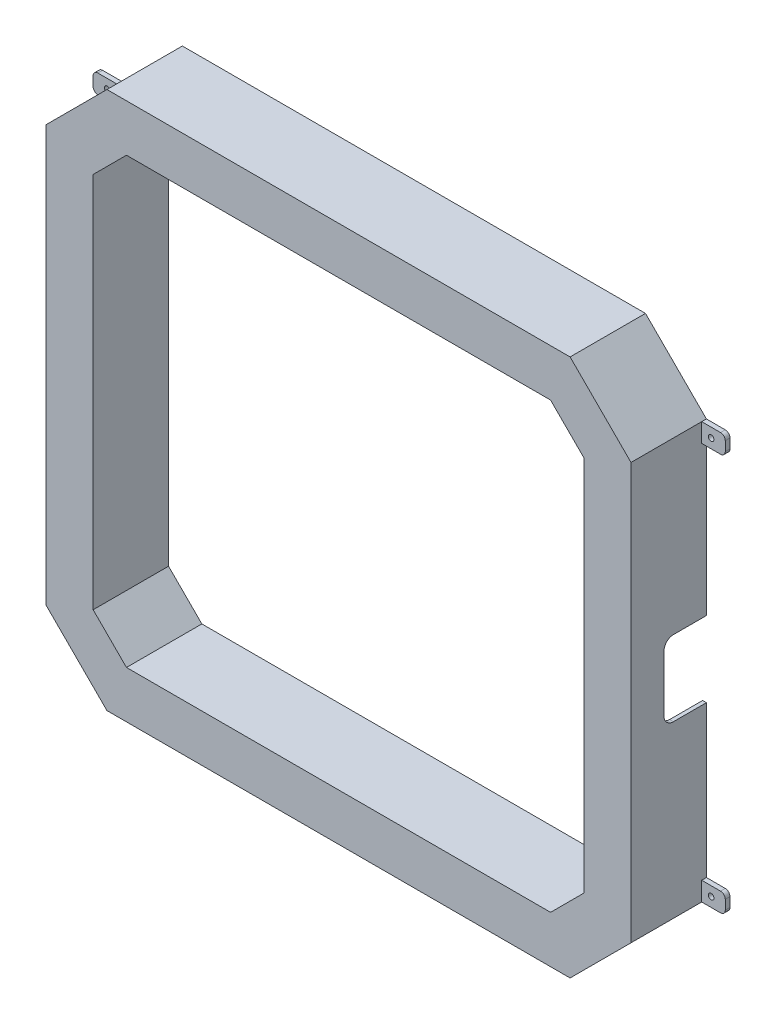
SolidWorks part; units mm, degrees
ref_plane "Plan de face" through (0, 0, 0) normal (0, 0, 1) x (1, 0, 0)
ref_plane "Plan de dessus" through (0, 0, 0) normal (0, 1, 0) x (1, 0, 0)
ref_plane "Plan de droite" through (0, 0, 0) normal (1, 0, 0) x (0, 0, -1)
sketch "Esquisse1" plane through (0, 0, 0) normal (0, 0, 1) x (1, 0, 0)
  line L0 (0, 0) -> (-450, 0)
  line L1 (-450, 0) -> (-485.3553, -35.3553)
  line L2 (-485.3553, -35.3553) -> (-485.3553, -435.3553)
  line L3 (-485.3553, -435.3553) -> (-450, -470.7107)
  line L4 (-450, -470.7107) -> (0, -470.7107)
  line L5 (0, -470.7107) -> (35.3553, -435.3553)
  line L6 (35.3553, -435.3553) -> (35.3553, -35.3553)
  line L7 (35.3553, -35.3553) -> (0, 0)
  line L8 (-535.3553, -14.6447) -> (-535.3553, -456.066)
  line L9 (-535.3553, -456.066) -> (-470.7107, -520.7107)
  line L10 (-470.7107, -520.7107) -> (20.7107, -520.7107)
  line L11 (20.7107, -520.7107) -> (85.3553, -456.066)
  line L12 (85.3553, -456.066) -> (85.3553, -14.6447)
  line L13 (85.3553, -14.6447) -> (20.7107, 50)
  line L14 (20.7107, 50) -> (-470.7107, 50)
  line L15 (-470.7107, 50) -> (-535.3553, -14.6447)
  point P6 (0, -539.506)
  point P10 (65.1411, -65.1411)
  point P11 (-409.4708, -587.2776)
  point P12 (0, 0)
  point P13 (0, 0)
  point P14 (67.5804, -517.5804)
  point P15 (0, -563.577)
  point P24 (-50, -483.1763)
  point P25 (-450, 0)
  point P26 (85.2384, -422.2618)
  point P27 (-450, -603.2595)
  point P28 (-450, -507.252)
  dimension "D1" = 450
  dimension "D2" = 400
  dimension "D3" = 135
  dimension "D4" = 50
  dimension "D5" = 135
  dimension "D6" = 50
extrude "Boss.-Extru.1" add sketch "Esquisse1" along normal blind 80
shell "Coque1" thickness 4
sketch "Esquisse2" plane through (85.3553, 0, 0) normal (1, 0, 0) x (0, 0, -1)
  line L0 (0, -195.3553) -> (-35, -195.3553)
  line L1 (0, -456.066) -> (0, -14.6447) construction
  line L3 (-45, -205.3553) -> (-45, -265.3553)
  line L4 (-35, -275.3553) -> (0, -275.3553)
  line L5 (0, -275.3553) -> (0, -195.3553)
  arc A0 (-35, -195.3553) -> (-45, -205.3553) centre (-35, -205.3553) ccw
  arc A1 (-45, -265.3553) -> (-35, -275.3553) centre (-35, -265.3553) ccw
  point P4 (0, -90.7541)
  point P5 (0, -235.3553)
  point P11 (0, -193.1025)
  point P13 (0, -273.1025)
  point P14 (0, 0)
  point P15 (0, -235.3553)
  dimension "D1" = 10
  dimension "D2" = 80
  dimension "D3" = 35
extrude "Enlèv. mat.-Extru.1" cut sketch "Esquisse2" against normal up to next
sketch "Esquisse3" plane through (-535.3553, 0, 0) normal (-1, 0, 0) x (0, 0, 1)
  line L4 (35, -195.3553) -> (0, -195.3553)
  line L5 (45, -265.3553) -> (45, -205.3553)
  line L6 (0, -275.3553) -> (35, -275.3553)
  line L7 (0, -195.3553) -> (0, -275.3553)
  line L8 (35, -195.3553) -> (0, -195.3553)
  line L9 (45, -265.3553) -> (45, -205.3553)
  line L10 (0, -275.3553) -> (35, -275.3553)
  line L11 (0, -195.3553) -> (0, -275.3553)
  arc A2 (45, -205.3553) -> (35, -195.3553) centre (35, -205.3553) ccw
  arc A3 (35, -275.3553) -> (45, -265.3553) centre (35, -265.3553) ccw
  arc A4 (45, -205.3553) -> (35, -195.3553) centre (35, -205.3553) ccw
  arc A5 (35, -275.3553) -> (45, -265.3553) centre (35, -265.3553) ccw
  dimension "D1" = 0
extrude "Enlèv. mat.-Extru.2" cut sketch "Esquisse3" against normal up to next
sketch "Esquisse5" plane through (0, 0, 0) normal (0, 0, -1) x (-1, 0, 0)
  line L0 (0, 0) -> (450, 0) construction
  line L1 (535.3553, -14.6447) -> (555.3553, -14.6447)
  line L2 (535.3553, -14.6447) -> (535.3553, -34.6447)
  line L3 (535.3553, -34.6447) -> (555.3553, -34.6447)
  line L4 (560.3553, -19.6447) -> (560.3553, -29.6447)
  line L5 (225, 0) -> (225, -470.7107) construction
  line L6 (450, -470.7107) -> (0, -470.7107) construction
  line L11 (225, -235.3553) -> (485.3553, -235.3553) construction
  line L12 (485.3553, -35.3553) -> (485.3553, -435.3553) construction
  line L22 (-110.3553, -19.6447) -> (-110.3553, -29.6447)
  line L23 (-85.3553, -34.6447) -> (-105.3553, -34.6447)
  line L24 (-85.3553, -14.6447) -> (-85.3553, -34.6447)
  line L25 (-85.3553, -14.6447) -> (-105.3553, -14.6447)
  line L26 (-85.3553, -456.066) -> (-105.3553, -456.066)
  line L27 (-85.3553, -456.066) -> (-85.3553, -436.066)
  line L28 (-85.3553, -436.066) -> (-105.3553, -436.066)
  line L29 (-110.3553, -451.066) -> (-110.3553, -441.066)
  line L30 (560.3553, -451.066) -> (560.3553, -441.066)
  line L31 (535.3553, -436.066) -> (555.3553, -436.066)
  line L32 (535.3553, -456.066) -> (535.3553, -436.066)
  line L33 (535.3553, -456.066) -> (555.3553, -456.066)
  circle A3 centre (545.3553, -24.6447) radius 3
  arc A4 (555.3553, -34.6447) -> (560.3553, -29.6447) centre (555.3553, -29.6447) ccw
  arc A5 (555.3553, -14.6447) -> (560.3553, -19.6447) centre (555.3553, -19.6447) cw
  arc A6 (-105.3553, -14.6447) -> (-110.3553, -19.6447) centre (-105.3553, -19.6447) ccw
  arc A7 (-105.3553, -34.6447) -> (-110.3553, -29.6447) centre (-105.3553, -29.6447) cw
  circle A8 centre (-95.3553, -24.6447) radius 3
  circle A9 centre (-95.3553, -446.066) radius 3
  arc A10 (-105.3553, -436.066) -> (-110.3553, -441.066) centre (-105.3553, -441.066) ccw
  arc A11 (-105.3553, -456.066) -> (-110.3553, -451.066) centre (-105.3553, -451.066) cw
  arc A12 (555.3553, -456.066) -> (560.3553, -451.066) centre (555.3553, -451.066) ccw
  arc A13 (555.3553, -436.066) -> (560.3553, -441.066) centre (555.3553, -441.066) cw
  circle A14 centre (545.3553, -446.066) radius 3
  point P29 (560.3553, -24.6447)
  point P40 (545.3553, -14.6447)
  point P43 (560.3553, -34.6447)
  point P46 (560.3553, -14.6447)
  dimension "D4" = 6
  dimension "D5" = 5
  dimension "D1" = 20
extrude "Boss.-Extru.2" add sketch "Esquisse5" against normal blind 5
sketch "Esquisse6" plane through (0, -520.7107, 0) normal (0, -1, 0) x (1, 0, 0)
  line L0 (-470.7107, 70) -> (20.7107, 70) construction
  line L1 (-470.7107, 80) -> (-470.7107, 0) construction
  line L2 (20.7107, 80) -> (20.7107, 0) construction
  line L3 (-470.7107, 80) -> (20.7107, 80) construction
  line L4 (-470.7107, 70) -> (-470.7107, 0) construction
  line L5 (-470.7107, 0) -> (20.7107, 0) construction
  line L6 (-470.7107, 35) -> (20.7107, 35) construction
  line L8 (-149.2893, 15) -> (-49.2893, 15)
  line L9 (-159.2893, 25) -> (-159.2893, 45)
  line L10 (-149.2893, 55) -> (-49.2893, 55)
  line L11 (-39.2893, 25) -> (-39.2893, 45)
  line L12 (-159.2893, 15) -> (-39.2893, 55) construction
  line L13 (-159.2893, 55) -> (-39.2893, 15) construction
  circle A0 centre (-390.7107, 35) radius 25
  circle A1 centre (-310.7107, 35) radius 15
  circle A2 centre (-230.7107, 35) radius 10
  arc A3 (-159.2893, 45) -> (-149.2893, 55) centre (-149.2893, 45) cw
  arc A4 (-149.2893, 15) -> (-159.2893, 25) centre (-149.2893, 25) cw
  arc A5 (-49.2893, 15) -> (-39.2893, 25) centre (-49.2893, 25) ccw
  arc A6 (-49.2893, 55) -> (-39.2893, 45) centre (-49.2893, 45) cw
  point P19 (-99.2893, 35)
  dimension "D2" = 50
  dimension "D3" = 30
  dimension "D4" = 20
  dimension "D11" = 10
  dimension "D1" = 10
  dimension "D5" = 80
  dimension "D6" = 80
  dimension "D7" = 80
  dimension "D8" = 120
  dimension "D9" = 40
  dimension "D10" = 60
extrude "Enlèv. mat.-Extru.3" cut sketch "Esquisse6" against normal up to next
